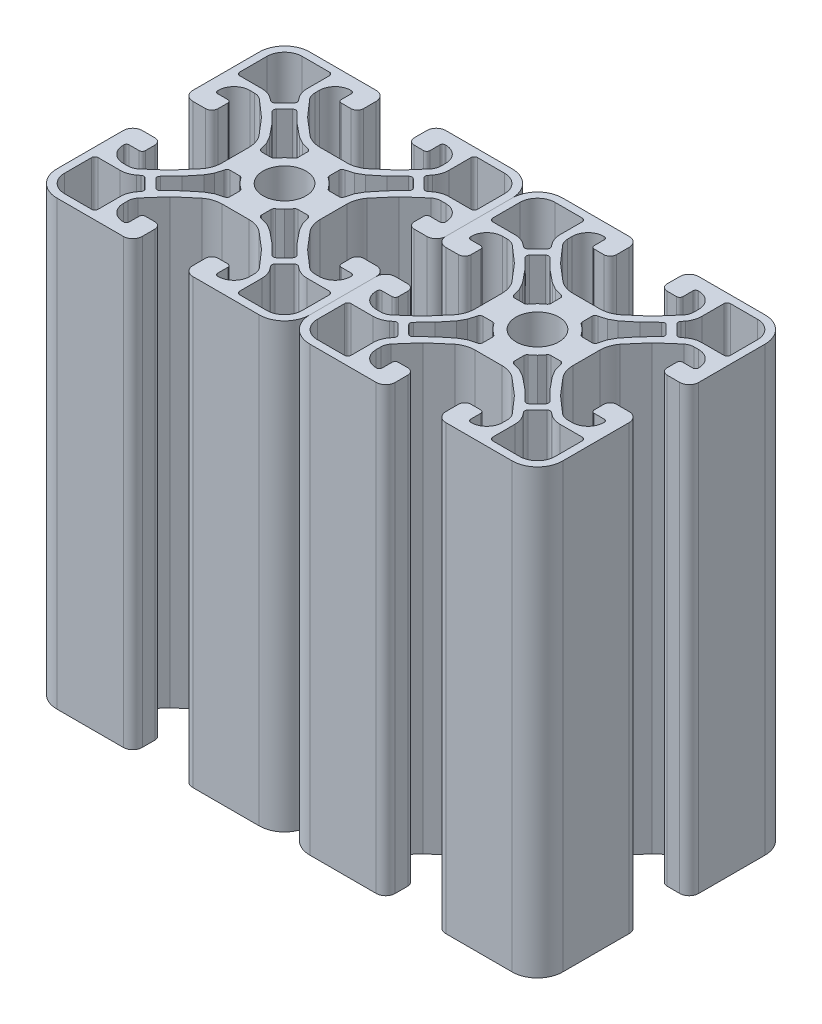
SolidWorks part; units mm, degrees
ref_plane "Ebene vorne" through (0, 0, 0) normal (0, 0, 1) x (1, 0, 0)
ref_plane "Ebene oben" through (0, 0, 0) normal (0, 1, 0) x (1, 0, 0)
ref_plane "Ebene rechts" through (0, 0, 0) normal (1, 0, 0) x (0, 0, -1)
sketch "Skizze1" plane through (0, 0, 0) normal (0, 0, 1) x (1, 0, 0)
  line L0 (-20, 35) -> (-20, -35)
  line L1 (20, -35) -> (20, 35)
  point P4 (0, 0)
  point P5 (0, 0)
  point P8 (-3.785, 8.8374)
other "Profile 10396_PRO4040E(1)"
ref_plane "Ebene1" through (-20, 35, 0) normal (0, -1, 0) x (1, 0, 0)
sketch "Model" plane through (-20, 35, 0) normal (0, -1, 0) x (1, 0, 0)
  line L1 (0, 20) -> (-20, 20) construction
  line L2 (-20, 20) -> (-20, 0) construction
  line L4 (14.7836, 10) -> (15.5, 10)
  line L5 (17.59, 7) -> (16, 7)
  line L6 (15.5, 6.5) -> (15.5, 5)
  line L7 (16.5, 4) -> (18.5, 4)
  line L8 (20, 5.5) -> (20, 16)
  line L9 (16, 20) -> (5.5, 20)
  line L10 (4, 18.5) -> (4, 16.5)
  line L11 (5, 15.5) -> (6.5, 15.5)
  line L12 (7, 16) -> (7, 17.59)
  line L13 (10, 15.5) -> (10, 14.7836)
  line L14 (6.119, 2.5) -> (4.6098, 2.5)
  line L15 (9.5499, 10.8148) -> (10.8148, 9.5499)
  line L16 (18.8, 16) -> (18.8, 11.7)
  line L17 (18.3, 11.2) -> (14.7836, 11.2)
  line L18 (12.8543, 10.553) -> (12.4466, 10.2386)
  line L19 (11.7838, 10.2779) -> (10.2779, 11.7838)
  line L20 (10.553, 12.8543) -> (10.2386, 12.4466)
  line L21 (11.2, 14.7836) -> (11.2, 18.3)
  line L22 (11.7, 18.8) -> (16, 18.8)
  line L23 (18, 7.5) -> (18, 7.41)
  line L24 (13.5778, 9.5957) -> (10.8702, 7.2249)
  line L25 (10.8702, 7.2249) -> (8.531, 4.4899)
  line L26 (7.5, 18) -> (7.41, 18)
  line L27 (8.8303, 10.8019) -> (7.0915, 9.0992)
  line L28 (-10, 14.7836) -> (-10, 15.5)
  line L29 (-7, 17.59) -> (-7, 16)
  line L30 (-6.5, 15.5) -> (-5, 15.5)
  line L31 (-4, 16.5) -> (-4, 18.5)
  line L32 (-5.5, 20) -> (-16, 20)
  line L33 (-20, 16) -> (-20, 5.5)
  line L34 (-18.5, 4) -> (-16.5, 4)
  line L35 (-15.5, 5) -> (-15.5, 6.5)
  line L36 (-16, 7) -> (-17.59, 7)
  line L37 (-15.5, 10) -> (-14.7836, 10)
  line L38 (7.0915, 9.0992) -> (5.2023, 7.5652)
  line L39 (10.8019, 8.8303) -> (9.0992, 7.0915)
  line L40 (9.0992, 7.0915) -> (7.5652, 5.2023)
  line L41 (5.2023, 7.5652) -> (4.1197, 6.9517)
  line L42 (7.5652, 5.2023) -> (6.9517, 4.1197)
  line L43 (6.9517, 4.1197) -> (6.613, 2.9224)
  line L44 (9.5957, 13.5778) -> (7.2249, 10.8702)
  line L45 (7.2249, 10.8702) -> (4.4899, 8.531)
  line L46 (20, 0) -> (20, 20) construction
  line L47 (4.1907, 2.7273) -> (3.5355, 3.5355)
  line L48 (3.5355, 3.5355) -> (2.7273, 4.1907)
  line L49 (2.5, 4.6098) -> (2.5, 6.119)
  line L50 (4.1197, 6.9517) -> (2.9224, 6.613)
  line L51 (20, 20) -> (0, 20) construction
  line L53 (0, 20) -> (0, 0) construction
  line L54 (-2.5, 6.119) -> (-2.5, 4.6098)
  line L55 (-4.6098, 2.5) -> (-6.119, 2.5)
  line L56 (-10.8148, 9.5499) -> (-9.5499, 10.8148)
  line L57 (-16, 18.8) -> (-11.7, 18.8)
  line L58 (-11.2, 18.3) -> (-11.2, 14.7836)
  line L59 (-10.553, 12.8543) -> (-10.2386, 12.4466)
  line L60 (-10.2779, 11.7838) -> (-11.7838, 10.2779)
  line L61 (-12.8543, 10.553) -> (-12.4466, 10.2386)
  line L62 (-14.7836, 11.2) -> (-18.3, 11.2)
  line L63 (-18.8, 11.7) -> (-18.8, 16)
  line L64 (10, -14.7836) -> (10, -15.5)
  line L65 (7, -17.59) -> (7, -16)
  line L66 (6.5, -15.5) -> (5, -15.5)
  line L67 (4, -16.5) -> (4, -18.5)
  line L68 (5.5, -20) -> (16, -20)
  line L69 (20, -16) -> (20, -5.5)
  line L70 (18.5, -4) -> (16.5, -4)
  line L71 (15.5, -5) -> (15.5, -6.5)
  line L72 (16, -7) -> (17.59, -7)
  line L73 (15.5, -10) -> (14.7836, -10)
  line L74 (2.5, -6.119) -> (2.5, -4.6098)
  line L75 (10.8148, -9.5499) -> (9.5499, -10.8148)
  line L76 (16, -18.8) -> (11.7, -18.8)
  line L77 (11.2, -18.3) -> (11.2, -14.7836)
  line L78 (10.553, -12.8543) -> (10.2386, -12.4466)
  line L79 (10.2779, -11.7838) -> (11.7838, -10.2779)
  line L80 (12.8543, -10.553) -> (12.4466, -10.2386)
  line L81 (14.7836, -11.2) -> (18.3, -11.2)
  line L82 (18.8, -11.7) -> (18.8, -16)
  line L83 (7.5, -18) -> (7.41, -18)
  line L84 (-7.5, 18) -> (-7.41, 18)
  line L85 (9.5957, -13.5778) -> (7.2249, -10.8702)
  line L86 (7.2249, -10.8702) -> (4.4899, -8.531)
  line L87 (18, -7.5) -> (18, -7.41)
  line L88 (10.8019, -8.8303) -> (9.0992, -7.0915)
  line L89 (-9.5957, 13.5778) -> (-7.2249, 10.8702)
  line L90 (-7.2249, 10.8702) -> (-4.4899, 8.531)
  line L91 (-18, 7.5) -> (-18, 7.41)
  line L92 (-10.8019, 8.8303) -> (-9.0992, 7.0915)
  line L93 (-9.0992, 7.0915) -> (-7.5652, 5.2023)
  line L94 (-8.8303, 10.8019) -> (-7.0915, 9.0992)
  line L95 (-7.0915, 9.0992) -> (-5.2023, 7.5652)
  line L96 (-7.5652, 5.2023) -> (-6.9517, 4.1197)
  line L97 (-6.9517, 4.1197) -> (-6.613, 2.9224)
  line L98 (-5.2023, 7.5652) -> (-4.1197, 6.9517)
  line L99 (-4.1197, 6.9517) -> (-2.9224, 6.613)
  line L100 (-2.7273, 4.1907) -> (-3.5355, 3.5355)
  line L101 (-3.5355, 3.5355) -> (-4.1907, 2.7273)
  line L102 (-13.5778, 9.5957) -> (-10.8702, 7.2249)
  line L103 (-10.8702, 7.2249) -> (-8.531, 4.4899)
  line L104 (9.0992, -7.0915) -> (7.5652, -5.2023)
  line L105 (8.8303, -10.8019) -> (7.0915, -9.0992)
  line L106 (7.0915, -9.0992) -> (5.2023, -7.5652)
  line L107 (7.5652, -5.2023) -> (6.9517, -4.1197)
  line L108 (5.2023, -7.5652) -> (4.1197, -6.9517)
  line L109 (4.1197, -6.9517) -> (2.9224, -6.613)
  line L110 (13.5778, -9.5957) -> (10.8702, -7.2249)
  line L111 (10.8702, -7.2249) -> (8.531, -4.4899)
  line L112 (0, -20) -> (20, -20) construction
  line L113 (2.7273, -4.1907) -> (3.5355, -3.5355)
  line L114 (3.5355, -3.5355) -> (4.1907, -2.7273)
  line L115 (4.6098, -2.5) -> (6.119, -2.5)
  line L116 (6.9517, -4.1197) -> (6.613, -2.9224)
  line L117 (20, -20) -> (20, 0) construction
  line L119 (20, 0) -> (0, 0) construction
  line L120 (-14.7836, -10) -> (-15.5, -10)
  line L121 (-17.59, -7) -> (-16, -7)
  line L122 (-15.5, -6.5) -> (-15.5, -5)
  line L123 (-16.5, -4) -> (-18.5, -4)
  line L124 (-20, -5.5) -> (-20, -16)
  line L125 (-16, -20) -> (-5.5, -20)
  line L126 (-4, -18.5) -> (-4, -16.5)
  line L127 (-5, -15.5) -> (-6.5, -15.5)
  line L128 (-7, -16) -> (-7, -17.59)
  line L129 (-10, -15.5) -> (-10, -14.7836)
  line L130 (-6.119, -2.5) -> (-4.6098, -2.5)
  line L131 (-9.5499, -10.8148) -> (-10.8148, -9.5499)
  line L132 (-18.8, -16) -> (-18.8, -11.7)
  line L133 (-18.3, -11.2) -> (-14.7836, -11.2)
  line L134 (-12.8543, -10.553) -> (-12.4466, -10.2386)
  line L135 (-11.7838, -10.2779) -> (-10.2779, -11.7838)
  line L136 (-10.553, -12.8543) -> (-10.2386, -12.4466)
  line L137 (-11.2, -14.7836) -> (-11.2, -18.3)
  line L138 (-11.7, -18.8) -> (-16, -18.8)
  line L139 (-18, -7.5) -> (-18, -7.41)
  line L140 (-13.5778, -9.5957) -> (-10.8702, -7.2249)
  line L141 (-10.8702, -7.2249) -> (-8.531, -4.4899)
  line L142 (-7.5, -18) -> (-7.41, -18)
  line L143 (-8.8303, -10.8019) -> (-7.0915, -9.0992)
  line L144 (-7.0915, -9.0992) -> (-5.2023, -7.5652)
  line L145 (-10.8019, -8.8303) -> (-9.0992, -7.0915)
  line L146 (-9.0992, -7.0915) -> (-7.5652, -5.2023)
  line L147 (-5.2023, -7.5652) -> (-4.1197, -6.9517)
  line L148 (-7.5652, -5.2023) -> (-6.9517, -4.1197)
  line L149 (-6.9517, -4.1197) -> (-6.613, -2.9224)
  line L150 (-9.5957, -13.5778) -> (-7.2249, -10.8702)
  line L151 (-7.2249, -10.8702) -> (-4.4899, -8.531)
  line L152 (-20, 0) -> (-20, -20) construction
  line L153 (-4.1907, -2.7273) -> (-3.5355, -3.5355)
  line L154 (-3.5355, -3.5355) -> (-2.7273, -4.1907)
  line L155 (-2.5, -4.6098) -> (-2.5, -6.119)
  line L156 (-4.1197, -6.9517) -> (-2.9224, -6.613)
  line L157 (-20, -20) -> (0, -20) construction
  line L158 (0, 0) -> (-20, 0) construction
  line L159 (0, -20) -> (0, 0) construction
  line L160 (-2.1156, 7.75) -> (2.1156, 7.75)
  line L161 (7.75, 2.1156) -> (7.75, -2.1156)
  line L162 (2.1156, -7.75) -> (-2.1156, -7.75)
  line L163 (-7.75, -2.1156) -> (-7.75, 2.1156)
  circle A0 centre (0, 0) radius 3.4
  arc A1 (8.531, 4.4899) -> (7.75, 2.1156) centre (11.75, 2.1156) ccw
  arc A2 (7.41, 18) -> (7, 17.59) centre (7.41, 17.59) ccw
  arc A3 (14.7836, 10) -> (13.5778, 9.5957) centre (14.7836, 8) ccw
  arc A4 (18, 7.5) -> (15.5, 10) centre (15.5, 7.5) ccw
  arc A5 (16, 7) -> (15.5, 6.5) centre (16, 6.5) ccw
  arc A6 (15.5, 5) -> (16.5, 4) centre (16.5, 5) ccw
  arc A7 (18.5, 4) -> (20, 5.5) centre (18.5, 5.5) ccw
  arc A8 (20, 16) -> (16, 20) centre (16, 16) ccw
  arc A9 (5.5, 20) -> (4, 18.5) centre (5.5, 18.5) ccw
  arc A10 (4, 16.5) -> (5, 15.5) centre (5, 16.5) ccw
  arc A11 (6.5, 15.5) -> (7, 16) centre (6.5, 16) ccw
  arc A12 (10, 15.5) -> (7.5, 18) centre (7.5, 15.5) ccw
  arc A13 (9.5957, 13.5778) -> (10, 14.7836) centre (8, 14.7836) ccw
  arc A14 (6.119, 2.5) -> (6.613, 2.9224) centre (6.119, 3) ccw
  arc A15 (4.1907, 2.7273) -> (4.6098, 2.5) centre (4.6098, 3) ccw
  arc A16 (9.5499, 10.8148) -> (8.8303, 10.8019) centre (9.1963, 10.4612) ccw
  arc A17 (10.8019, 8.8303) -> (10.8148, 9.5499) centre (10.4612, 9.1963) ccw
  arc A18 (18.8, 16) -> (16, 18.8) centre (16, 16) ccw
  arc A19 (18.3, 11.2) -> (18.8, 11.7) centre (18.3, 11.7) ccw
  arc A20 (14.7836, 11.2) -> (12.8543, 10.553) centre (14.7836, 8) ccw
  arc A21 (11.7838, 10.2779) -> (12.4466, 10.2386) centre (12.1374, 10.6315) ccw
  arc A22 (10.2386, 12.4466) -> (10.2779, 11.7838) centre (10.6315, 12.1374) ccw
  arc A23 (10.553, 12.8543) -> (11.2, 14.7836) centre (8, 14.7836) ccw
  arc A24 (11.7, 18.8) -> (11.2, 18.3) centre (11.7, 18.3) ccw
  arc A25 (18, 7.41) -> (17.59, 7) centre (17.59, 7.41) cw
  arc A26 (2.5, 4.6098) -> (2.7273, 4.1907) centre (3, 4.6098) ccw
  arc A27 (2.9224, 6.613) -> (2.5, 6.119) centre (3, 6.119) ccw
  arc A28 (2.1156, 7.75) -> (4.4899, 8.531) centre (2.1156, 11.75) ccw
  arc A29 (4.4899, -8.531) -> (2.1156, -7.75) centre (2.1156, -11.75) ccw
  arc A30 (18, -7.41) -> (17.59, -7) centre (17.59, -7.41) ccw
  arc A31 (10, -14.7836) -> (9.5957, -13.5778) centre (8, -14.7836) ccw
  arc A32 (7.5, -18) -> (10, -15.5) centre (7.5, -15.5) ccw
  arc A33 (7, -16) -> (6.5, -15.5) centre (6.5, -16) ccw
  arc A34 (5, -15.5) -> (4, -16.5) centre (5, -16.5) ccw
  arc A35 (4, -18.5) -> (5.5, -20) centre (5.5, -18.5) ccw
  arc A36 (16, -20) -> (20, -16) centre (16, -16) ccw
  arc A37 (20, -5.5) -> (18.5, -4) centre (18.5, -5.5) ccw
  arc A38 (16.5, -4) -> (15.5, -5) centre (16.5, -5) ccw
  arc A39 (15.5, -6.5) -> (16, -7) centre (16, -6.5) ccw
  arc A40 (15.5, -10) -> (18, -7.5) centre (15.5, -7.5) ccw
  arc A41 (13.5778, -9.5957) -> (14.7836, -10) centre (14.7836, -8) ccw
  arc A42 (2.5, -6.119) -> (2.9224, -6.613) centre (3, -6.119) ccw
  arc A43 (-4.4899, 8.531) -> (-2.1156, 7.75) centre (-2.1156, 11.75) ccw
  arc A44 (-18, 7.41) -> (-17.59, 7) centre (-17.59, 7.41) ccw
  arc A45 (-10, 14.7836) -> (-9.5957, 13.5778) centre (-8, 14.7836) ccw
  arc A46 (-7.5, 18) -> (-10, 15.5) centre (-7.5, 15.5) ccw
  arc A47 (2.7273, -4.1907) -> (2.5, -4.6098) centre (3, -4.6098) ccw
  arc A48 (-7, 16) -> (-6.5, 15.5) centre (-6.5, 16) ccw
  arc A49 (-5, 15.5) -> (-4, 16.5) centre (-5, 16.5) ccw
  arc A50 (-4, 18.5) -> (-5.5, 20) centre (-5.5, 18.5) ccw
  arc A51 (-16, 20) -> (-20, 16) centre (-16, 16) ccw
  arc A52 (-20, 5.5) -> (-18.5, 4) centre (-18.5, 5.5) ccw
  arc A53 (-16.5, 4) -> (-15.5, 5) centre (-16.5, 5) ccw
  arc A54 (-15.5, 6.5) -> (-16, 7) centre (-16, 6.5) ccw
  arc A55 (10.8148, -9.5499) -> (10.8019, -8.8303) centre (10.4612, -9.1963) ccw
  arc A56 (-15.5, 10) -> (-18, 7.5) centre (-15.5, 7.5) ccw
  arc A57 (-13.5778, 9.5957) -> (-14.7836, 10) centre (-14.7836, 8) ccw
  arc A58 (8.8303, -10.8019) -> (9.5499, -10.8148) centre (9.1963, -10.4612) ccw
  arc A59 (-7.75, 2.1156) -> (-8.531, 4.4899) centre (-11.75, 2.1156) ccw
  arc A60 (16, -18.8) -> (18.8, -16) centre (16, -16) ccw
  arc A61 (11.2, -18.3) -> (11.7, -18.8) centre (11.7, -18.3) ccw
  arc A62 (11.2, -14.7836) -> (10.553, -12.8543) centre (8, -14.7836) ccw
  arc A63 (10.2779, -11.7838) -> (10.2386, -12.4466) centre (10.6315, -12.1374) ccw
  arc A64 (12.4466, -10.2386) -> (11.7838, -10.2779) centre (12.1374, -10.6315) ccw
  arc A65 (12.8543, -10.553) -> (14.7836, -11.2) centre (14.7836, -8) ccw
  arc A66 (18.8, -11.7) -> (18.3, -11.2) centre (18.3, -11.7) ccw
  arc A67 (7.41, -18) -> (7, -17.59) centre (7.41, -17.59) cw
  arc A68 (4.6098, -2.5) -> (4.1907, -2.7273) centre (4.6098, -3) ccw
  arc A69 (6.613, -2.9224) -> (6.119, -2.5) centre (6.119, -3) ccw
  arc A70 (7.75, -2.1156) -> (8.531, -4.4899) centre (11.75, -2.1156) ccw
  arc A71 (-8.531, -4.4899) -> (-7.75, -2.1156) centre (-11.75, -2.1156) ccw
  arc A72 (-7.41, -18) -> (-7, -17.59) centre (-7.41, -17.59) ccw
  arc A73 (-14.7836, -10) -> (-13.5778, -9.5957) centre (-14.7836, -8) ccw
  arc A74 (-18, -7.5) -> (-15.5, -10) centre (-15.5, -7.5) ccw
  arc A75 (-16, -7) -> (-15.5, -6.5) centre (-16, -6.5) ccw
  arc A76 (-15.5, -5) -> (-16.5, -4) centre (-16.5, -5) ccw
  arc A77 (-18.5, -4) -> (-20, -5.5) centre (-18.5, -5.5) ccw
  arc A78 (-20, -16) -> (-16, -20) centre (-16, -16) ccw
  arc A79 (-5.5, -20) -> (-4, -18.5) centre (-5.5, -18.5) ccw
  arc A80 (-4, -16.5) -> (-5, -15.5) centre (-5, -16.5) ccw
  arc A81 (-6.5, -15.5) -> (-7, -16) centre (-6.5, -16) ccw
  arc A82 (-10, -15.5) -> (-7.5, -18) centre (-7.5, -15.5) ccw
  arc A83 (-9.5957, -13.5778) -> (-10, -14.7836) centre (-8, -14.7836) ccw
  arc A84 (-6.119, -2.5) -> (-6.613, -2.9224) centre (-6.119, -3) ccw
  arc A85 (-4.1907, -2.7273) -> (-4.6098, -2.5) centre (-4.6098, -3) ccw
  arc A86 (-9.5499, -10.8148) -> (-8.8303, -10.8019) centre (-9.1963, -10.4612) ccw
  arc A87 (-10.8019, -8.8303) -> (-10.8148, -9.5499) centre (-10.4612, -9.1963) ccw
  arc A88 (-2.5, 6.119) -> (-2.9224, 6.613) centre (-3, 6.119) ccw
  arc A89 (-2.7273, 4.1907) -> (-2.5, 4.6098) centre (-3, 4.6098) ccw
  arc A90 (-18.8, -16) -> (-16, -18.8) centre (-16, -16) ccw
  arc A91 (-4.6098, 2.5) -> (-4.1907, 2.7273) centre (-4.6098, 3) ccw
  arc A92 (-6.613, 2.9224) -> (-6.119, 2.5) centre (-6.119, 3) ccw
  arc A93 (-18.3, -11.2) -> (-18.8, -11.7) centre (-18.3, -11.7) ccw
  arc A94 (-14.7836, -11.2) -> (-12.8543, -10.553) centre (-14.7836, -8) ccw
  arc A95 (-10.8148, 9.5499) -> (-10.8019, 8.8303) centre (-10.4612, 9.1963) ccw
  arc A96 (-8.8303, 10.8019) -> (-9.5499, 10.8148) centre (-9.1963, 10.4612) ccw
  arc A97 (-11.7838, -10.2779) -> (-12.4466, -10.2386) centre (-12.1374, -10.6315) ccw
  arc A98 (-16, 18.8) -> (-18.8, 16) centre (-16, 16) ccw
  arc A99 (-11.2, 18.3) -> (-11.7, 18.8) centre (-11.7, 18.3) ccw
  arc A100 (-11.2, 14.7836) -> (-10.553, 12.8543) centre (-8, 14.7836) ccw
  arc A101 (-10.2779, 11.7838) -> (-10.2386, 12.4466) centre (-10.6315, 12.1374) ccw
  arc A102 (-12.4466, 10.2386) -> (-11.7838, 10.2779) centre (-12.1374, 10.6315) ccw
  arc A103 (-12.8543, 10.553) -> (-14.7836, 11.2) centre (-14.7836, 8) ccw
  arc A104 (-18.8, 11.7) -> (-18.3, 11.2) centre (-18.3, 11.7) ccw
  arc A105 (-10.2386, -12.4466) -> (-10.2779, -11.7838) centre (-10.6315, -12.1374) ccw
  arc A106 (-10.553, -12.8543) -> (-11.2, -14.7836) centre (-8, -14.7836) ccw
  arc A107 (-11.7, -18.8) -> (-11.2, -18.3) centre (-11.7, -18.3) ccw
  arc A108 (-18, -7.41) -> (-17.59, -7) centre (-17.59, -7.41) cw
  arc A109 (-2.5, -4.6098) -> (-2.7273, -4.1907) centre (-3, -4.6098) ccw
  arc A110 (-2.9224, -6.613) -> (-2.5, -6.119) centre (-3, -6.119) ccw
  arc A111 (-2.1156, -7.75) -> (-4.4899, -8.531) centre (-2.1156, -11.75) ccw
  arc A141 (-7.41, 18) -> (-7, 17.59) centre (-7.41, 17.59) cw
  point P2 (0, 0)
  point P377 (0, 0)
  dimension "D1" = 4
  dimension "D2" = 40
  dimension "D3" = 40
equation "\"D3@Skizze1\"=\"D2@Skizze1\"/2"
equation "\"D4@Skizze1\"=\"D1@Skizze1\"/2"
